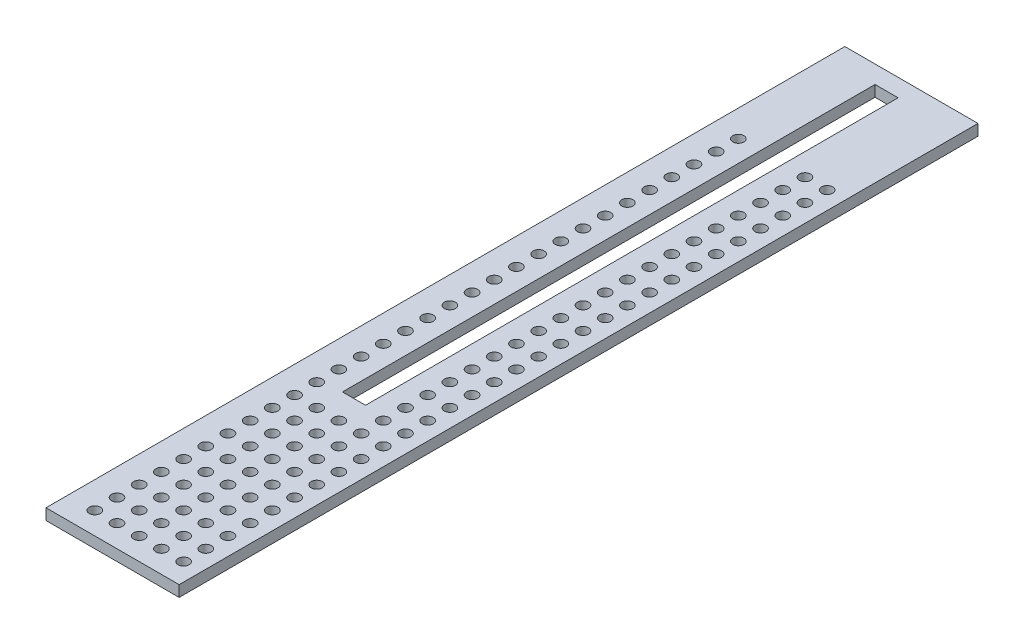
SolidWorks part; units mm, degrees
ref_plane "Front Plane" through (0, 0, 0) normal (0, 0, 1) x (1, 0, 0)
ref_plane "Top Plane" through (0, 0, 0) normal (0, 1, 0) x (1, 0, 0)
ref_plane "Right Plane" through (0, 0, 0) normal (1, 0, 0) x (0, 0, -1)
sketch "Sketch1" plane through (0, 0, 0) normal (0, 0, 1) x (1, 0, 0)
  line L0 (1.5875, 47.625) -> (36.5125, 47.625)
  line L1 (1.5875, -50.8) -> (-1.5875, -50.8)
  line L2 (1.5875, -50.8) -> (1.5875, 47.625)
  line L4 (-1.5875, -50.8) -> (-1.5875, 50.8)
  line L5 (1.5875, -50.8) -> (-1.5875, 50.8) construction
  line L6 (3.5127, 112.4075) -> (-1.5875, -50.8) construction
  line L7 (-1.5875, 50.8) -> (36.5125, 50.8)
  line L10 (36.5125, 50.8) -> (36.5125, 47.625)
  point P0 (0, 0)
  point P7 (0, -50.8)
extrude "Boss-Extrude1" add sketch "Sketch1" along normal blind 228.6
sketch "Sketch2" plane through (1.5875, 0, 0) normal (1, 0, 0) x (0, 0, -1)
  line L0 (-228.6, -29.4596) -> (0, 47.625) construction
  line L1 (-228.6, -50.8) -> (-228.6, 47.625) construction
  line L2 (-228.6, 47.625) -> (0, 47.625) construction
  line L3 (0, -50.8) -> (0, 47.625) construction
ref_plane "Plane1 - BACKBOARD PLANE" through (0, 42.7626, 14.4197) normal (0, -0.9476, -0.3195) x (0, 0.3195, -0.9476)
ref_plane "Plane1" through (0, -1.5875, 0) normal (0, -1, 0) x (-1, 0, 0)
sketch "Sketch3" plane through (-1.5875, 0, 0) normal (-1, 0, 0) x (0, 0, 1)
  line L0 (228.6, -50.8) -> (0, -50.8) construction
  line L1 (82.55, -32.385) -> (6.35, -32.385)
  line L2 (82.55, -32.385) -> (82.55, -38.735)
  line L3 (82.55, -38.735) -> (6.35, -38.735)
  line L4 (6.35, -32.385) -> (6.35, -38.735)
  line L5 (82.55, -32.385) -> (6.35, -38.735) construction
  line L6 (82.55, -38.735) -> (6.35, -32.385) construction
  line L7 (0, 50.8) -> (0, -50.8) construction
  line L18 (6.35, 33.1888) -> (82.55, 33.1888)
  line L19 (6.35, 33.1888) -> (6.35, 26.2472)
  line L20 (6.35, 26.2472) -> (82.55, 26.2472)
  line L21 (82.55, 33.1888) -> (82.55, 26.2472)
  point P0 (44.45, -35.56)
  point P13 (6.35, 29.718)
  point P14 (6.35, -35.56)
  dimension "D1" = 6.35
  dimension "D2" = 15.24
  dimension "D3" = 76.2
  dimension "D4" = 6.35
  dimension "D5" = 65.278
extrude "Cut-Extrude1" cut sketch "Sketch3" against normal up to next
sketch "Sketch4" plane through (-1.5875, 0, 0) normal (-1, 0, 0) x (0, 0, 1)
  circle A0 centre (103.8185, 40.3289) radius 1.5875
  circle A1 centre (110.1685, 40.3289) radius 1.5875
  circle A2 centre (116.5185, 40.3289) radius 1.5875
  circle A3 centre (122.8685, 40.3289) radius 1.5875
  circle A4 centre (129.2185, 40.3289) radius 1.5875
  circle A5 centre (110.1685, 33.9789) radius 1.5875
  circle A6 centre (116.5185, 33.9789) radius 1.5875
  circle A7 centre (122.8685, 33.9789) radius 1.5875
  circle A8 centre (129.2185, 33.9789) radius 1.5875
  circle A9 centre (110.1685, 27.6289) radius 1.5875
  circle A10 centre (116.5185, 27.6289) radius 1.5875
  circle A11 centre (122.8685, 27.6289) radius 1.5875
  circle A12 centre (129.2185, 27.6289) radius 1.5875
  circle A13 centre (110.1685, 21.2789) radius 1.5875
  circle A14 centre (116.5185, 21.2789) radius 1.5875
  circle A15 centre (122.8685, 21.2789) radius 1.5875
  circle A16 centre (129.2185, 21.2789) radius 1.5875
  circle A17 centre (103.8185, 33.9789) radius 1.5875
  circle A18 centre (103.8185, 27.6289) radius 1.5875
  circle A19 centre (103.8185, 21.2789) radius 1.5875
  circle A20 centre (135.5685, 40.3289) radius 1.5875
  circle A21 centre (141.9185, 40.3289) radius 1.5875
  circle A22 centre (148.2685, 40.3289) radius 1.5875
  circle A23 centre (154.6185, 40.3289) radius 1.5875
  circle A24 centre (160.9685, 40.3289) radius 1.5875
  circle A25 centre (167.3185, 40.3289) radius 1.5875
  circle A26 centre (173.6685, 40.3289) radius 1.5875
  circle A27 centre (180.0185, 40.3289) radius 1.5875
  circle A28 centre (186.3685, 40.3289) radius 1.5875
  circle A29 centre (192.7185, 40.3289) radius 1.5875
  circle A30 centre (199.0685, 40.3289) radius 1.5875
  circle A31 centre (205.4185, 40.3289) radius 1.5875
  circle A32 centre (211.7685, 40.3289) radius 1.5875
  circle A33 centre (218.1185, 40.3289) radius 1.5875
  circle A34 centre (135.5685, 33.9789) radius 1.5875
  circle A35 centre (141.9185, 33.9789) radius 1.5875
  circle A36 centre (148.2685, 33.9789) radius 1.5875
  circle A37 centre (154.6185, 33.9789) radius 1.5875
  circle A38 centre (160.9685, 33.9789) radius 1.5875
  circle A39 centre (167.3185, 33.9789) radius 1.5875
  circle A40 centre (173.6685, 33.9789) radius 1.5875
  circle A41 centre (180.0185, 33.9789) radius 1.5875
  circle A42 centre (186.3685, 33.9789) radius 1.5875
  circle A43 centre (192.7185, 33.9789) radius 1.5875
  circle A44 centre (199.0685, 33.9789) radius 1.5875
  circle A45 centre (205.4185, 33.9789) radius 1.5875
  circle A46 centre (211.7685, 33.9789) radius 1.5875
  circle A47 centre (218.1185, 33.9789) radius 1.5875
  circle A48 centre (135.5685, 27.6289) radius 1.5875
  circle A49 centre (141.9185, 27.6289) radius 1.5875
  circle A50 centre (148.2685, 27.6289) radius 1.5875
  circle A51 centre (154.6185, 27.6289) radius 1.5875
  circle A52 centre (160.9685, 27.6289) radius 1.5875
  circle A53 centre (167.3185, 27.6289) radius 1.5875
  circle A54 centre (173.6685, 27.6289) radius 1.5875
  circle A55 centre (180.0185, 27.6289) radius 1.5875
  circle A56 centre (186.3685, 27.6289) radius 1.5875
  circle A57 centre (192.7185, 27.6289) radius 1.5875
  circle A58 centre (199.0685, 27.6289) radius 1.5875
  circle A59 centre (205.4185, 27.6289) radius 1.5875
  circle A60 centre (211.7685, 27.6289) radius 1.5875
  circle A61 centre (218.1185, 27.6289) radius 1.5875
  circle A62 centre (135.5685, 21.2789) radius 1.5875
  circle A63 centre (141.9185, 21.2789) radius 1.5875
  circle A64 centre (148.2685, 21.2789) radius 1.5875
  circle A65 centre (154.6185, 21.2789) radius 1.5875
  circle A66 centre (160.9685, 21.2789) radius 1.5875
  circle A67 centre (167.3185, 21.2789) radius 1.5875
  circle A68 centre (173.6685, 21.2789) radius 1.5875
  circle A69 centre (180.0185, 21.2789) radius 1.5875
  circle A70 centre (186.3685, 21.2789) radius 1.5875
  circle A71 centre (192.7185, 21.2789) radius 1.5875
  circle A72 centre (199.0685, 21.2789) radius 1.5875
  circle A73 centre (205.4185, 21.2789) radius 1.5875
  circle A74 centre (211.7685, 21.2789) radius 1.5875
  circle A75 centre (218.1185, 21.2789) radius 1.5875
  circle A76 centre (103.8185, 14.9289) radius 1.5875
  circle A77 centre (110.1685, 14.9289) radius 1.5875
  circle A78 centre (116.5185, 14.9289) radius 1.5875
  circle A79 centre (122.8685, 14.9289) radius 1.5875
  circle A80 centre (129.2185, 14.9289) radius 1.5875
  circle A81 centre (135.5685, 14.9289) radius 1.5875
  circle A82 centre (141.9185, 14.9289) radius 1.5875
  circle A83 centre (148.2685, 14.9289) radius 1.5875
  circle A84 centre (154.6185, 14.9289) radius 1.5875
  circle A85 centre (160.9685, 14.9289) radius 1.5875
  circle A86 centre (167.3185, 14.9289) radius 1.5875
  circle A87 centre (173.6685, 14.9289) radius 1.5875
  circle A88 centre (180.0185, 14.9289) radius 1.5875
  circle A89 centre (186.3685, 14.9289) radius 1.5875
  circle A90 centre (192.7185, 14.9289) radius 1.5875
  circle A91 centre (199.0685, 14.9289) radius 1.5875
  circle A92 centre (205.4185, 14.9289) radius 1.5875
  circle A93 centre (211.7685, 14.9289) radius 1.5875
  circle A94 centre (218.1185, 14.9289) radius 1.5875
  circle A95 centre (103.8185, 8.5789) radius 1.5875
  circle A96 centre (110.1685, 8.5789) radius 1.5875
  circle A97 centre (116.5185, 8.5789) radius 1.5875
  circle A98 centre (122.8685, 8.5789) radius 1.5875
  circle A99 centre (129.2185, 8.5789) radius 1.5875
  circle A100 centre (135.5685, 8.5789) radius 1.5875
  circle A101 centre (141.9185, 8.5789) radius 1.5875
  circle A102 centre (148.2685, 8.5789) radius 1.5875
  circle A103 centre (154.6185, 8.5789) radius 1.5875
  circle A104 centre (160.9685, 8.5789) radius 1.5875
  circle A105 centre (167.3185, 8.5789) radius 1.5875
  circle A106 centre (173.6685, 8.5789) radius 1.5875
  circle A107 centre (180.0185, 8.5789) radius 1.5875
  circle A108 centre (186.3685, 8.5789) radius 1.5875
  circle A109 centre (192.7185, 8.5789) radius 1.5875
  circle A110 centre (199.0685, 8.5789) radius 1.5875
  circle A111 centre (205.4185, 8.5789) radius 1.5875
  circle A112 centre (211.7685, 8.5789) radius 1.5875
  circle A113 centre (218.1185, 8.5789) radius 1.5875
  circle A114 centre (103.8185, 2.2289) radius 1.5875
  circle A115 centre (110.1685, 2.2289) radius 1.5875
  circle A116 centre (116.5185, 2.2289) radius 1.5875
  circle A117 centre (122.8685, 2.2289) radius 1.5875
  circle A118 centre (129.2185, 2.2289) radius 1.5875
  circle A119 centre (135.5685, 2.2289) radius 1.5875
  circle A120 centre (141.9185, 2.2289) radius 1.5875
  circle A121 centre (148.2685, 2.2289) radius 1.5875
  circle A122 centre (154.6185, 2.2289) radius 1.5875
  circle A123 centre (160.9685, 2.2289) radius 1.5875
  circle A124 centre (167.3185, 2.2289) radius 1.5875
  circle A125 centre (173.6685, 2.2289) radius 1.5875
  circle A126 centre (180.0185, 2.2289) radius 1.5875
  circle A127 centre (186.3685, 2.2289) radius 1.5875
  circle A128 centre (192.7185, 2.2289) radius 1.5875
  circle A129 centre (199.0685, 2.2289) radius 1.5875
  circle A130 centre (205.4185, 2.2289) radius 1.5875
  circle A131 centre (211.7685, 2.2289) radius 1.5875
  circle A132 centre (218.1185, 2.2289) radius 1.5875
  circle A133 centre (103.8185, -4.1211) radius 1.5875
  circle A134 centre (110.1685, -4.1211) radius 1.5875
  circle A135 centre (116.5185, -4.1211) radius 1.5875
  circle A136 centre (122.8685, -4.1211) radius 1.5875
  circle A137 centre (129.2185, -4.1211) radius 1.5875
  circle A138 centre (135.5685, -4.1211) radius 1.5875
  circle A139 centre (141.9185, -4.1211) radius 1.5875
  circle A140 centre (148.2685, -4.1211) radius 1.5875
  circle A141 centre (154.6185, -4.1211) radius 1.5875
  circle A142 centre (160.9685, -4.1211) radius 1.5875
  circle A143 centre (167.3185, -4.1211) radius 1.5875
  circle A144 centre (173.6685, -4.1211) radius 1.5875
  circle A145 centre (180.0185, -4.1211) radius 1.5875
  circle A146 centre (186.3685, -4.1211) radius 1.5875
  circle A147 centre (192.7185, -4.1211) radius 1.5875
  circle A148 centre (199.0685, -4.1211) radius 1.5875
  circle A149 centre (205.4185, -4.1211) radius 1.5875
  circle A150 centre (211.7685, -4.1211) radius 1.5875
  circle A151 centre (218.1185, -4.1211) radius 1.5875
  circle A152 centre (103.8185, -10.4711) radius 1.5875
  circle A153 centre (110.1685, -10.4711) radius 1.5875
  circle A154 centre (116.5185, -10.4711) radius 1.5875
  circle A155 centre (122.8685, -10.4711) radius 1.5875
  circle A156 centre (129.2185, -10.4711) radius 1.5875
  circle A157 centre (135.5685, -10.4711) radius 1.5875
  circle A158 centre (141.9185, -10.4711) radius 1.5875
  circle A159 centre (148.2685, -10.4711) radius 1.5875
  circle A160 centre (154.6185, -10.4711) radius 1.5875
  circle A161 centre (160.9685, -10.4711) radius 1.5875
  circle A162 centre (167.3185, -10.4711) radius 1.5875
  circle A163 centre (173.6685, -10.4711) radius 1.5875
  circle A164 centre (180.0185, -10.4711) radius 1.5875
  circle A165 centre (186.3685, -10.4711) radius 1.5875
  circle A166 centre (192.7185, -10.4711) radius 1.5875
  circle A167 centre (199.0685, -10.4711) radius 1.5875
  circle A168 centre (205.4185, -10.4711) radius 1.5875
  circle A169 centre (211.7685, -10.4711) radius 1.5875
  circle A170 centre (218.1185, -10.4711) radius 1.5875
  circle A171 centre (103.8185, -16.8211) radius 1.5875
  circle A172 centre (110.1685, -16.8211) radius 1.5875
  circle A173 centre (116.5185, -16.8211) radius 1.5875
  circle A174 centre (122.8685, -16.8211) radius 1.5875
  circle A175 centre (129.2185, -16.8211) radius 1.5875
  circle A176 centre (135.5685, -16.8211) radius 1.5875
  circle A177 centre (141.9185, -16.8211) radius 1.5875
  circle A178 centre (148.2685, -16.8211) radius 1.5875
  circle A179 centre (154.6185, -16.8211) radius 1.5875
  circle A180 centre (160.9685, -16.8211) radius 1.5875
  circle A181 centre (167.3185, -16.8211) radius 1.5875
  circle A182 centre (173.6685, -16.8211) radius 1.5875
  circle A183 centre (180.0185, -16.8211) radius 1.5875
  circle A184 centre (186.3685, -16.8211) radius 1.5875
  circle A185 centre (192.7185, -16.8211) radius 1.5875
  circle A186 centre (199.0685, -16.8211) radius 1.5875
  circle A187 centre (205.4185, -16.8211) radius 1.5875
  circle A188 centre (211.7685, -16.8211) radius 1.5875
  circle A189 centre (218.1185, -16.8211) radius 1.5875
  circle A190 centre (103.8185, -23.1711) radius 1.5875
  circle A191 centre (110.1685, -23.1711) radius 1.5875
  circle A192 centre (116.5185, -23.1711) radius 1.5875
  circle A193 centre (122.8685, -23.1711) radius 1.5875
  circle A194 centre (129.2185, -23.1711) radius 1.5875
  circle A195 centre (135.5685, -23.1711) radius 1.5875
  circle A196 centre (141.9185, -23.1711) radius 1.5875
  circle A197 centre (148.2685, -23.1711) radius 1.5875
  circle A198 centre (154.6185, -23.1711) radius 1.5875
  circle A199 centre (160.9685, -23.1711) radius 1.5875
  circle A200 centre (167.3185, -23.1711) radius 1.5875
  circle A201 centre (173.6685, -23.1711) radius 1.5875
  circle A202 centre (180.0185, -23.1711) radius 1.5875
  circle A203 centre (186.3685, -23.1711) radius 1.5875
  circle A204 centre (192.7185, -23.1711) radius 1.5875
  circle A205 centre (199.0685, -23.1711) radius 1.5875
  circle A206 centre (205.4185, -23.1711) radius 1.5875
  circle A207 centre (211.7685, -23.1711) radius 1.5875
  circle A208 centre (218.1185, -23.1711) radius 1.5875
  circle A209 centre (103.8185, -29.5211) radius 1.5875
  circle A210 centre (110.1685, -29.5211) radius 1.5875
  circle A211 centre (116.5185, -29.5211) radius 1.5875
  circle A212 centre (122.8685, -29.5211) radius 1.5875
  circle A213 centre (129.2185, -29.5211) radius 1.5875
  circle A214 centre (135.5685, -29.5211) radius 1.5875
  circle A215 centre (141.9185, -29.5211) radius 1.5875
  circle A216 centre (148.2685, -29.5211) radius 1.5875
  circle A217 centre (154.6185, -29.5211) radius 1.5875
  circle A218 centre (160.9685, -29.5211) radius 1.5875
  circle A219 centre (167.3185, -29.5211) radius 1.5875
  circle A220 centre (173.6685, -29.5211) radius 1.5875
  circle A221 centre (180.0185, -29.5211) radius 1.5875
  circle A222 centre (186.3685, -29.5211) radius 1.5875
  circle A223 centre (192.7185, -29.5211) radius 1.5875
  circle A224 centre (199.0685, -29.5211) radius 1.5875
  circle A225 centre (205.4185, -29.5211) radius 1.5875
  circle A226 centre (211.7685, -29.5211) radius 1.5875
  circle A227 centre (218.1185, -29.5211) radius 1.5875
  circle A228 centre (103.8185, -35.8711) radius 1.5875
  circle A229 centre (110.1685, -35.8711) radius 1.5875
  circle A230 centre (116.5185, -35.8711) radius 1.5875
  circle A231 centre (122.8685, -35.8711) radius 1.5875
  circle A232 centre (129.2185, -35.8711) radius 1.5875
  circle A233 centre (135.5685, -35.8711) radius 1.5875
  circle A234 centre (141.9185, -35.8711) radius 1.5875
  circle A235 centre (148.2685, -35.8711) radius 1.5875
  circle A236 centre (154.6185, -35.8711) radius 1.5875
  circle A237 centre (160.9685, -35.8711) radius 1.5875
  circle A238 centre (167.3185, -35.8711) radius 1.5875
  circle A239 centre (173.6685, -35.8711) radius 1.5875
  circle A240 centre (180.0185, -35.8711) radius 1.5875
  circle A241 centre (186.3685, -35.8711) radius 1.5875
  circle A242 centre (192.7185, -35.8711) radius 1.5875
  circle A243 centre (199.0685, -35.8711) radius 1.5875
  circle A244 centre (205.4185, -35.8711) radius 1.5875
  circle A245 centre (211.7685, -35.8711) radius 1.5875
  circle A246 centre (218.1185, -35.8711) radius 1.5875
  circle A247 centre (103.8185, -42.2211) radius 1.5875
  circle A248 centre (110.1685, -42.2211) radius 1.5875
  circle A249 centre (116.5185, -42.2211) radius 1.5875
  circle A250 centre (122.8685, -42.2211) radius 1.5875
  circle A251 centre (129.2185, -42.2211) radius 1.5875
  circle A252 centre (135.5685, -42.2211) radius 1.5875
  circle A253 centre (141.9185, -42.2211) radius 1.5875
  circle A254 centre (148.2685, -42.2211) radius 1.5875
  circle A255 centre (154.6185, -42.2211) radius 1.5875
  circle A256 centre (160.9685, -42.2211) radius 1.5875
  circle A257 centre (167.3185, -42.2211) radius 1.5875
  circle A258 centre (173.6685, -42.2211) radius 1.5875
  circle A259 centre (180.0185, -42.2211) radius 1.5875
  circle A260 centre (186.3685, -42.2211) radius 1.5875
  circle A261 centre (192.7185, -42.2211) radius 1.5875
  circle A262 centre (199.0685, -42.2211) radius 1.5875
  circle A263 centre (205.4185, -42.2211) radius 1.5875
  circle A264 centre (211.7685, -42.2211) radius 1.5875
  circle A265 centre (218.1185, -42.2211) radius 1.5875
  dimension "D1" = 3.175
  dimension "D2" = 19
  dimension "D3" = 14
extrude "Cut-Extrude2" cut sketch "Sketch4" against normal up to next (3.175 mm away)
sketch "Sketch5" plane through (0, 50.8, 0) normal (0, 1, 0) x (1, 0, 0)
  line L0 (36.5125, 0) -> (-1.5875, 0) construction
  line L1 (18.7325, -5.08) -> (12.1285, -5.08)
  line L2 (18.7325, -5.08) -> (18.7325, -157.48)
  line L3 (18.7325, -157.48) -> (12.1285, -157.48)
  line L4 (12.1285, -5.08) -> (12.1285, -157.48)
  line L5 (36.5125, -228.6) -> (36.5125, 0) construction
  point P8 (15.4305, -5.08)
  dimension "D1" = 6.604
  dimension "D2" = 152.4
  dimension "D3" = 5.08
  dimension "D4" = 21.082
extrude "Cut-Extrude3" cut sketch "Sketch5" against normal up to next
sketch "Sketch6" plane through (0, 50.8, 0) normal (0, 1, 0) x (1, 0, 0)
  line L0 (36.5125, -228.6) -> (-1.5875, -228.6) construction
  line L1 (36.5125, -228.6) -> (36.5125, 0) construction
  circle A0 centre (6.0325, -222.25) radius 1.5875
  circle A1 centre (12.3825, -222.25) radius 1.5875
  circle A2 centre (18.7325, -222.25) radius 1.5875
  circle A3 centre (25.0825, -222.25) radius 1.5875
  circle A4 centre (31.4325, -222.25) radius 1.5875
  circle A5 centre (12.3825, -215.9) radius 1.5875
  circle A6 centre (18.7325, -215.9) radius 1.5875
  circle A7 centre (25.0825, -215.9) radius 1.5875
  circle A8 centre (31.4325, -215.9) radius 1.5875
  circle A9 centre (12.3825, -209.55) radius 1.5875
  circle A10 centre (18.7325, -209.55) radius 1.5875
  circle A11 centre (25.0825, -209.55) radius 1.5875
  circle A12 centre (31.4325, -209.55) radius 1.5875
  circle A13 centre (12.3825, -203.2) radius 1.5875
  circle A14 centre (18.7325, -203.2) radius 1.5875
  circle A15 centre (25.0825, -203.2) radius 1.5875
  circle A16 centre (31.4325, -203.2) radius 1.5875
  circle A17 centre (12.3825, -196.85) radius 1.5875
  circle A18 centre (18.7325, -196.85) radius 1.5875
  circle A19 centre (25.0825, -196.85) radius 1.5875
  circle A20 centre (31.4325, -196.85) radius 1.5875
  circle A21 centre (12.3825, -190.5) radius 1.5875
  circle A22 centre (18.7325, -190.5) radius 1.5875
  circle A23 centre (25.0825, -190.5) radius 1.5875
  circle A24 centre (31.4325, -190.5) radius 1.5875
  circle A25 centre (12.3825, -184.15) radius 1.5875
  circle A26 centre (18.7325, -184.15) radius 1.5875
  circle A27 centre (25.0825, -184.15) radius 1.5875
  circle A28 centre (31.4325, -184.15) radius 1.5875
  circle A29 centre (12.3825, -177.8) radius 1.5875
  circle A30 centre (18.7325, -177.8) radius 1.5875
  circle A31 centre (25.0825, -177.8) radius 1.5875
  circle A32 centre (31.4325, -177.8) radius 1.5875
  circle A33 centre (12.3825, -171.45) radius 1.5875
  circle A34 centre (18.7325, -171.45) radius 1.5875
  circle A35 centre (25.0825, -171.45) radius 1.5875
  circle A36 centre (31.4325, -171.45) radius 1.5875
  circle A37 centre (12.3825, -165.1) radius 1.5875
  circle A38 centre (18.7325, -165.1) radius 1.5875
  circle A39 centre (25.0825, -165.1) radius 1.5875
  circle A40 centre (31.4325, -165.1) radius 1.5875
  circle A43 centre (25.0825, -158.75) radius 1.5875
  circle A44 centre (31.4325, -158.75) radius 1.5875
  circle A47 centre (25.0825, -152.4) radius 1.5875
  circle A48 centre (31.4325, -152.4) radius 1.5875
  circle A51 centre (25.0825, -146.05) radius 1.5875
  circle A52 centre (31.4325, -146.05) radius 1.5875
  circle A55 centre (25.0825, -139.7) radius 1.5875
  circle A56 centre (31.4325, -139.7) radius 1.5875
  circle A59 centre (25.0825, -133.35) radius 1.5875
  circle A60 centre (31.4325, -133.35) radius 1.5875
  circle A63 centre (25.0825, -127) radius 1.5875
  circle A64 centre (31.4325, -127) radius 1.5875
  circle A67 centre (25.0825, -120.65) radius 1.5875
  circle A68 centre (31.4325, -120.65) radius 1.5875
  circle A71 centre (25.0825, -114.3) radius 1.5875
  circle A72 centre (31.4325, -114.3) radius 1.5875
  circle A75 centre (25.0825, -107.95) radius 1.5875
  circle A76 centre (31.4325, -107.95) radius 1.5875
  circle A79 centre (25.0825, -101.6) radius 1.5875
  circle A80 centre (31.4325, -101.6) radius 1.5875
  circle A83 centre (25.0825, -95.25) radius 1.5875
  circle A84 centre (31.4325, -95.25) radius 1.5875
  circle A87 centre (25.0825, -88.9) radius 1.5875
  circle A88 centre (31.4325, -88.9) radius 1.5875
  circle A91 centre (25.0825, -82.55) radius 1.5875
  circle A92 centre (31.4325, -82.55) radius 1.5875
  circle A95 centre (25.0825, -76.2) radius 1.5875
  circle A96 centre (31.4325, -76.2) radius 1.5875
  circle A99 centre (25.0825, -69.85) radius 1.5875
  circle A100 centre (31.4325, -69.85) radius 1.5875
  circle A103 centre (25.0825, -63.5) radius 1.5875
  circle A104 centre (31.4325, -63.5) radius 1.5875
  circle A107 centre (25.0825, -57.15) radius 1.5875
  circle A108 centre (31.4325, -57.15) radius 1.5875
  circle A111 centre (25.0825, -50.8) radius 1.5875
  circle A112 centre (31.4325, -50.8) radius 1.5875
  circle A115 centre (25.0825, -44.45) radius 1.5875
  circle A116 centre (31.4325, -44.45) radius 1.5875
  circle A119 centre (25.0825, -38.1) radius 1.5875
  circle A120 centre (31.4325, -38.1) radius 1.5875
  circle A121 centre (6.0325, -215.9) radius 1.5875
  circle A122 centre (6.0325, -209.55) radius 1.5875
  circle A123 centre (6.0325, -203.2) radius 1.5875
  circle A124 centre (6.0325, -196.85) radius 1.5875
  circle A125 centre (6.0325, -190.5) radius 1.5875
  circle A126 centre (6.0325, -184.15) radius 1.5875
  circle A127 centre (6.0325, -177.8) radius 1.5875
  circle A128 centre (6.0325, -171.45) radius 1.5875
  circle A129 centre (6.0325, -165.1) radius 1.5875
  circle A130 centre (6.0325, -158.75) radius 1.5875
  circle A131 centre (6.0325, -152.4) radius 1.5875
  circle A132 centre (6.0325, -146.05) radius 1.5875
  circle A133 centre (6.0325, -139.7) radius 1.5875
  circle A134 centre (6.0325, -133.35) radius 1.5875
  circle A135 centre (6.0325, -127) radius 1.5875
  circle A136 centre (6.0325, -120.65) radius 1.5875
  circle A137 centre (6.0325, -114.3) radius 1.5875
  circle A138 centre (6.0325, -107.95) radius 1.5875
  circle A139 centre (6.0325, -101.6) radius 1.5875
  circle A140 centre (6.0325, -95.25) radius 1.5875
  circle A141 centre (6.0325, -88.9) radius 1.5875
  circle A142 centre (6.0325, -82.55) radius 1.5875
  circle A143 centre (6.0325, -76.2) radius 1.5875
  circle A144 centre (6.0325, -69.85) radius 1.5875
  circle A145 centre (6.0325, -63.5) radius 1.5875
  circle A146 centre (6.0325, -57.15) radius 1.5875
  circle A147 centre (6.0325, -50.8) radius 1.5875
  circle A148 centre (6.0325, -44.45) radius 1.5875
  circle A149 centre (6.0325, -38.1) radius 1.5875
  circle A150 centre (18.7325, -50.8) radius 1.5875
  circle A151 centre (12.3825, -44.45) radius 1.5875
  circle A152 centre (18.7325, -44.45) radius 1.5875
  circle A153 centre (12.3825, -38.1) radius 1.5875
  circle A154 centre (18.7325, -38.1) radius 1.5875
  circle A155 centre (12.3825, -63.5) radius 1.5875
  circle A156 centre (18.7325, -63.5) radius 1.5875
  circle A157 centre (12.3825, -57.15) radius 1.5875
  circle A158 centre (18.7325, -57.15) radius 1.5875
  circle A159 centre (12.3825, -50.8) radius 1.5875
  circle A160 centre (12.3825, -158.75) radius 1.5875
  circle A161 centre (18.7325, -158.75) radius 1.5875
  circle A162 centre (12.3825, -152.4) radius 1.5875
  circle A163 centre (18.7325, -152.4) radius 1.5875
  circle A164 centre (12.3825, -146.05) radius 1.5875
  circle A165 centre (18.7325, -146.05) radius 1.5875
  circle A166 centre (12.3825, -139.7) radius 1.5875
  circle A167 centre (18.7325, -139.7) radius 1.5875
  circle A168 centre (12.3825, -133.35) radius 1.5875
  circle A169 centre (18.7325, -133.35) radius 1.5875
  circle A170 centre (12.3825, -127) radius 1.5875
  circle A171 centre (18.7325, -127) radius 1.5875
  circle A172 centre (12.3825, -120.65) radius 1.5875
  circle A173 centre (18.7325, -120.65) radius 1.5875
  circle A174 centre (12.3825, -114.3) radius 1.5875
  circle A175 centre (18.7325, -114.3) radius 1.5875
  circle A176 centre (12.3825, -107.95) radius 1.5875
  circle A177 centre (18.7325, -107.95) radius 1.5875
  circle A178 centre (12.3825, -101.6) radius 1.5875
  circle A179 centre (18.7325, -101.6) radius 1.5875
  circle A180 centre (12.3825, -95.25) radius 1.5875
  circle A181 centre (18.7325, -95.25) radius 1.5875
  circle A182 centre (12.3825, -88.9) radius 1.5875
  circle A183 centre (18.7325, -88.9) radius 1.5875
  circle A184 centre (12.3825, -82.55) radius 1.5875
  circle A185 centre (18.7325, -82.55) radius 1.5875
  circle A186 centre (12.3825, -76.2) radius 1.5875
  circle A187 centre (18.7325, -76.2) radius 1.5875
  circle A188 centre (12.3825, -69.85) radius 1.5875
  circle A189 centre (18.7325, -69.85) radius 1.5875
  dimension "D1" = 3.175
  dimension "D2" = 6.35
  dimension "D3" = 30.48
  dimension "D4" = 5
  dimension "D5" = 30
extrude "Cut-Extrude4" cut sketch "Sketch6" against normal up to next (3.175 mm away)
ref_plane "Plane2" through (1.5875, 0, 0) normal (1, 0, 0) x (0, 0, -1)
sketch "Sketch7" plane through (-1.5875, 0, 0) normal (-1, 0, 0) x (0, 0, 1)
  line L1 (228.6, -50.8) -> (0, -50.8)
  line L2 (228.6, -50.8) -> (228.6, 47.625)
  line L3 (228.6, 47.625) -> (0, 47.625)
  line L4 (0, -50.8) -> (0, 47.625)
extrude "Cut-Extrude5" cut sketch "Sketch7" against normal up to next
equation "\"eighthinch\"= 0.125"
equation "\"D2@Sketch1\"=\"eighthinch\""
